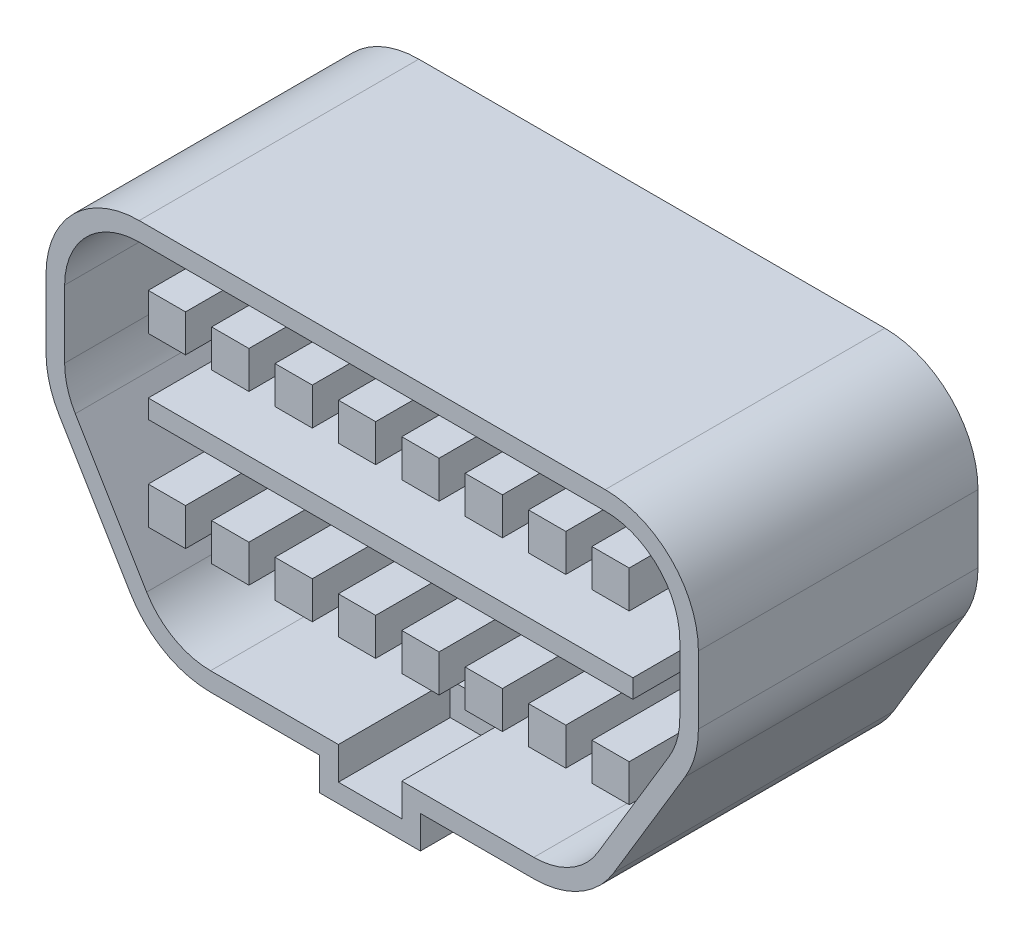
SolidWorks part; units mm, degrees
ref_plane "Front Plane" through (0, 0, 0) normal (0, 0, 1) x (1, 0, 0)
ref_plane "Top Plane" through (0, 0, 0) normal (0, 1, 0) x (1, 0, 0)
ref_plane "Right Plane" through (0, 0, 0) normal (1, 0, 0) x (0, 0, -1)
sketch "Sketch1" plane through (0, 0, 0) normal (0, 0, 1) x (1, 0, 0)
  line L1 (0, 0) -> (35, 0)
  line L2 (0, 0) -> (0, 20)
  line L3 (0, 20) -> (35, 20)
  line L4 (35, 0) -> (35, 20)
  dimension "D1" = 35
  dimension "D2" = 20
extrude "Boss-Extrude1" add sketch "Sketch1" along normal blind 15
chamfer "Chamfer1" distance 6 angle 59 1 edges at (0, 0, 7.5)
chamfer "Chamfer2" distance 6 angle 59 1 edges at (35, 0, 7.5)
fillet "Fillet1" radius 5 1 edges at (0, 9.9857, 7.5)
fillet "Fillet2" radius 5 1 edges at (35, 9.9857, 7.5)
fillet "Fillet3" radius 5 1 edges at (6, 0, 7.5)
fillet "Fillet4" radius 5 1 edges at (29, 0, 7.5)
fillet "Fillet5" radius 5 1 edges at (0, 20, 7.5)
fillet "Fillet6" radius 5 1 edges at (35, 20, 7.5)
shell "Shell2" thickness 1
sketch "Sketch2" plane through (0, 0, 1) normal (0, 0, 1) x (1, 0, 0)
  line L0 (8.8289, 0) -> (26.1711, 0) construction
  line L1 (4.4858, 11) -> (30.4858, 11)
  line L2 (4.4858, 11) -> (4.4858, 10)
  line L3 (4.4858, 10) -> (30.4858, 10)
  line L4 (30.4858, 11) -> (30.4858, 10)
  dimension "D1" = 1
  dimension "D2" = 26
  dimension "D3" = 10
extrude "Boss-Extrude2" add sketch "Sketch2" along normal blind 13
sketch "Sketch3" plane through (0, 0, 1) normal (0, 0, 1) x (1, 0, 0)
  line L0 (30.4858, 11) -> (4.4858, 11) construction
  line L1 (4.4858, 16) -> (6.4858, 16)
  line L2 (4.4858, 16) -> (4.4858, 14)
  line L3 (4.4858, 14) -> (6.4858, 14)
  line L4 (6.4858, 16) -> (6.4858, 14)
  line L5 (4.4858, 11) -> (4.4858, 10) construction
  dimension "D1" = 2
  dimension "D2" = 2
  dimension "D3" = 3
  dimension "D4" = 0
extrude "Boss-Extrude3" add sketch "Sketch3" along normal blind 13
pattern_linear "LPattern2" count 8 spacing 3.4 along (1, 0, 0) of "Boss-Extrude3"
sketch "Sketch4" plane through (0, 0, 1) normal (0, 0, 1) x (1, 0, 0)
  line L0 (30.4858, 11) -> (4.4858, 11) construction
  line L1 (4.4858, 7) -> (6.4858, 7)
  line L2 (4.4858, 7) -> (4.4858, 5)
  line L3 (4.4858, 5) -> (6.4858, 5)
  line L4 (6.4858, 7) -> (6.4858, 5)
  line L5 (4.4858, 11) -> (4.4858, 10) construction
  dimension "D1" = 2
  dimension "D2" = 2
  dimension "D3" = 4
  dimension "D4" = 0
extrude "Boss-Extrude4" add sketch "Sketch4" along normal blind 13
pattern_linear "LPattern3" count 8 spacing 3.4 along (1, 0, 0) of "Boss-Extrude4"
sketch "Sketch5" plane through (0, 0, 0) normal (0, -1, 0) x (1, 0, 0)
  line L0 (8.8289, 15) -> (26.1711, 15) construction
  line L1 (14.6858, 15) -> (20.0858, 15)
  line L2 (14.6858, 15) -> (14.6858, 8)
  line L3 (14.6858, 8) -> (20.0858, 8)
  line L4 (20.0858, 15) -> (20.0858, 8)
  line L5 (14.6858, 14) -> (14.6858, 1) construction
  line L6 (20.0858, 14) -> (20.0858, 1) construction
  point P6 (14.6858, 11.5)
  dimension "D1" = 0
  dimension "D2" = 0
  dimension "D3" = 7
extrude "Boss-Extrude5" add sketch "Sketch5" along normal blind 1.75
sketch "Sketch6" plane through (0, 1, 0) normal (0, 1, 0) x (1, 0, 0)
  line L0 (8.8289, -15) -> (26.1711, -15) construction
  line L1 (15.6858, -15) -> (19.0858, -15)
  line L2 (15.6858, -15) -> (15.6858, -9)
  line L3 (15.6858, -9) -> (19.0858, -9)
  line L4 (19.0858, -15) -> (19.0858, -9)
  line L5 (14.6858, -15) -> (14.6858, -8) construction
  line L6 (20.0858, -8) -> (20.0858, -15) construction
  dimension "D1" = 6
  dimension "D2" = 1
  dimension "D3" = 1
extrude "Cut-Extrude1" cut sketch "Sketch6" against normal blind 1.75
